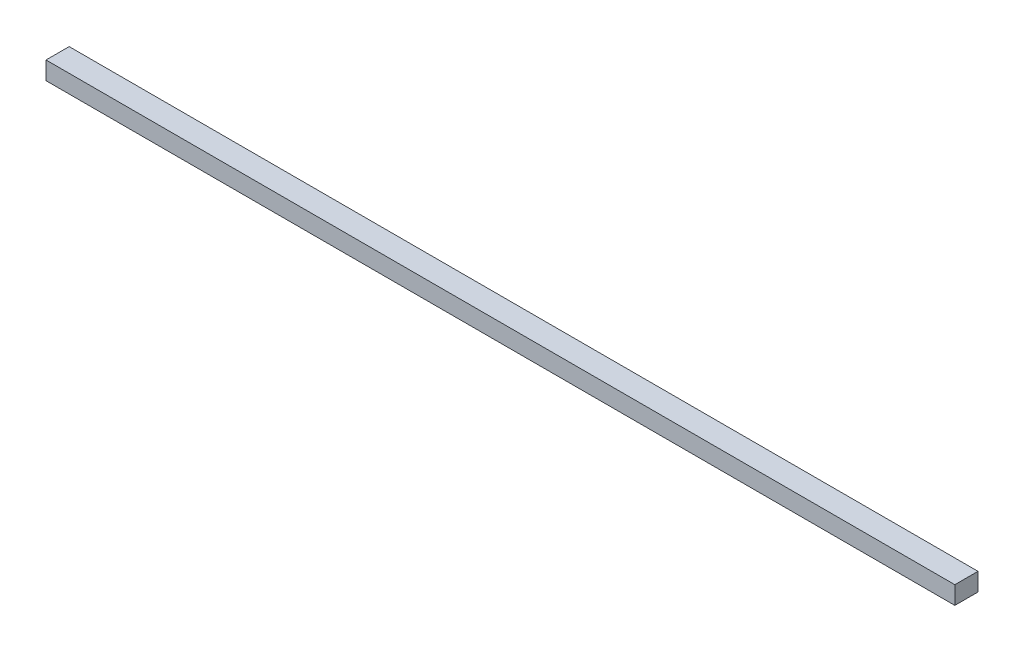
SolidWorks part; units mm, degrees
ref_plane "Front Plane" through (0, 0, 0) normal (0, 0, 1) x (1, 0, 0)
ref_plane "Top Plane" through (0, 0, 0) normal (0, 1, 0) x (1, 0, 0)
ref_plane "Right Plane" through (0, 0, 0) normal (1, 0, 0) x (0, 0, -1)
sketch "Sketch1" plane through (0, 0, 0) normal (0, 1, 0) x (1, 0, 0)
  line L1 (-321.4688, -8.1915) -> (321.4687, -8.1915)
  line L2 (-321.4688, -8.1915) -> (-321.4688, 8.1915)
  line L3 (-321.4688, 8.1915) -> (321.4687, 8.1915)
  line L4 (321.4687, -8.1915) -> (321.4687, 8.1915)
  line L5 (-321.4688, -8.1915) -> (321.4687, 8.1915) construction
  line L6 (-321.4688, 8.1915) -> (321.4687, -8.1915) construction
  point P0 (0, 0)
  dimension "D1" = 16.383
  dimension "D2" = 642.9375
extrude "Boss-Extrude1" add sketch "Sketch1" along normal blind 12.7
